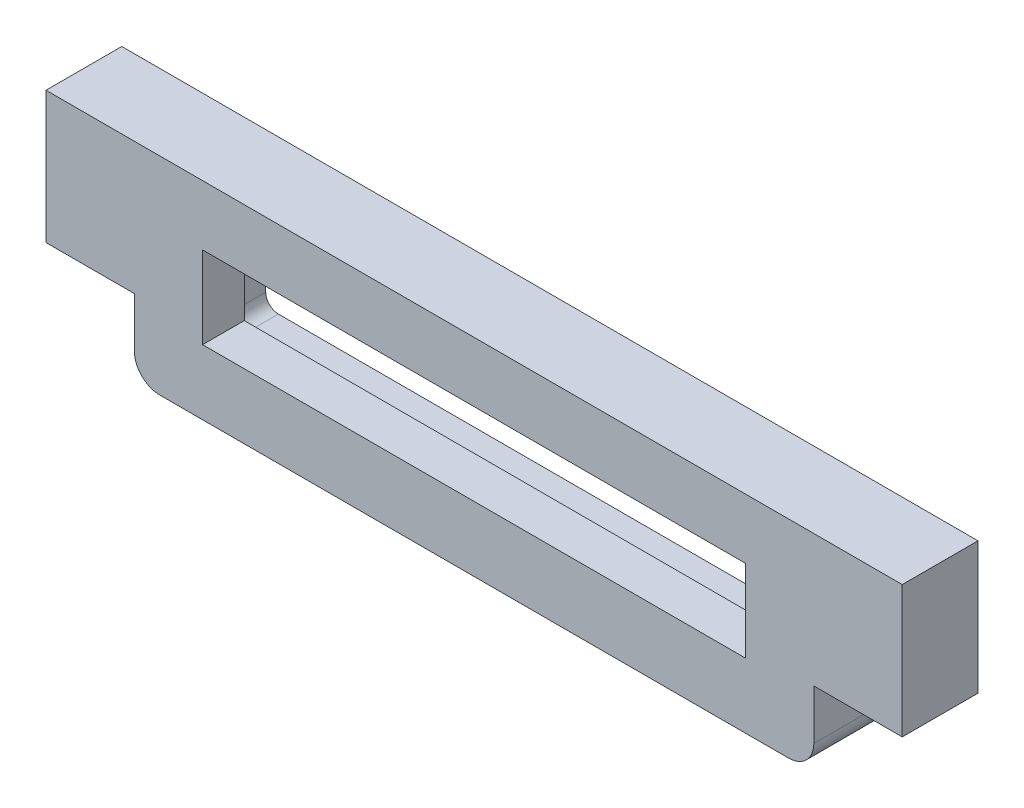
SolidWorks part; units mm, degrees
ref_plane "Front Plane" through (0, 0, 0) normal (0, 0, 1) x (1, 0, 0)
ref_plane "Top Plane" through (0, 0, 0) normal (0, 1, 0) x (1, 0, 0)
ref_plane "Right Plane" through (0, 0, 0) normal (1, 0, 0) x (0, 0, -1)
sketch "Sketch1" plane through (0, 0, 0) normal (0, 0, 1) x (1, 0, 0)
  line L0 (0, 20.5563) -> (0, -8) construction
  line L1 (-28.8085, 0) -> (32.7718, 0) construction
  line L3 (26.9, 8.4) -> (-26.9, 8.4)
  line L4 (26.9, 8.4) -> (26.9, -8.4)
  line L5 (26.9, -8.4) -> (-26.9, -8.4)
  line L6 (-26.9, 8.4) -> (-26.9, -8.4)
  line L7 (26.9, 8.4) -> (-26.9, -8.4) construction
  line L8 (26.9, -8.4) -> (-26.9, 8.4) construction
  line L12 (-21, 2.75) -> (-21, -2.75)
  line L17 (-21, -2.75) -> (21, -2.75)
  line L18 (21, -2.75) -> (21, 2.75)
  line L19 (21, 2.75) -> (-21, 2.75)
  point P5 (0, 0)
  point P10 (0, 0)
  point P13 (0, 2.75)
  point P16 (21, 0)
  dimension "D1" = 16.8
  dimension "D2" = 42
  dimension "D3" = 5.9
  dimension "D4" = 5.5
  dimension "D5" = 53.8
extrude "Boss-Extrude1" add sketch "Sketch1" along normal mid plane 54
sketch "Sketch4" plane through (0, 0, 0) normal (0, 0, 1) x (1, 0, 0)
  line L0 (21, -2.75) -> (21, 2.75) construction
  line L1 (-21, -2.75) -> (21, -2.75) construction
  line L2 (-21, 2.75) -> (-21, -2.75) construction
  line L3 (21, 2.75) -> (-21, 2.75) construction
  line L4 (21, -2.75) -> (21, 2.75) construction
  line L5 (-21, -2.75) -> (21, -2.75) construction
  line L6 (-21, 2.75) -> (-21, -2.75) construction
  line L7 (21, 2.75) -> (-21, 2.75) construction
  line L8 (22.2, -3.95) -> (22.2, 3.95)
  line L9 (22.2, 3.95) -> (-22.2, 3.95)
  line L10 (-22.2, 3.95) -> (-22.2, -3.95)
  line L11 (-22.2, -3.95) -> (22.2, -3.95)
  line L12 (-26.9, -8.4) -> (26.9, -8.4) construction
  line L13 (26.9, -8.4) -> (26.9, 8.4) construction
  line L14 (26.9, 8.4) -> (-26.9, 8.4) construction
  line L15 (-26.9, 8.4) -> (-26.9, -8.4) construction
  line L16 (-26.9, -8.4) -> (26.9, -8.4)
  line L17 (26.9, -8.4) -> (26.9, 8.4)
  line L18 (26.9, 8.4) -> (-26.9, 8.4)
  line L19 (-26.9, 8.4) -> (-26.9, -8.4)
  dimension "D1" = 1.2
extrude "Cut-Extrude2" cut sketch "Sketch4" against normal mid plane 38.7
sketch "Sketch2" plane through (0, 0, 19.35) normal (0, 0, -1) x (-1, 0, 0)
  line L0 (0, 12.8087) -> (0, -16.4683) construction
  line L1 (21, -2.75) -> (-21, -2.75) construction
  line L3 (-26.9, -2.45) -> (-26.9, 7.55)
  line L6 (-26.9, -2.45) -> (-33.9, -2.45)
  line L7 (-26.9, -2.45) -> (-26.9, 7.55)
  line L8 (-26.9, 7.55) -> (-33.9, 7.55)
  line L9 (-33.9, -2.45) -> (-33.9, 7.55)
  line L13 (-26.9, -8.4) -> (-26.9, 8.4) construction
  line L16 (33.9, -2.45) -> (33.9, 7.55)
  line L17 (26.9, 7.55) -> (33.9, 7.55)
  line L18 (26.9, -2.45) -> (26.9, 7.55)
  line L19 (26.9, -2.45) -> (33.9, -2.45)
  line L20 (26.9, -2.45) -> (26.9, 7.55)
  dimension "D1" = 7
  dimension "D2" = 10
  dimension "D3" = 0.3
extrude "Boss-Extrude2" add sketch "Sketch2" against normal blind 6 contours L9 L6 L3 L8 | L17 L18 L19 L16
sketch "Sketch3" plane through (0, -2.45, 0) normal (0, -1, 0) x (1, 0, 0)
  line L0 (0, 34.141) -> (0, 0) construction
  line L1 (-26.9, 25.35) -> (-26.9, 19.35) construction
  line L4 (-33.9, 19.35) -> (-33.9, 25.35) construction
  circle A0 centre (-30.7, 22.35) radius 1.35
  circle A2 centre (30.7, 22.35) radius 1.35
  point P10 (-33.9, 22.35)
  dimension "D1" = 2.7
  dimension "D2" = 3.8
extrude "Cut-Extrude1" cut sketch "Sketch3" against normal blind 8 contours A0 | A2
mirror "Mirror8" about plane through (0, 0, 0) normal (0, 0, 1) of "Cut-Extrude1", "Boss-Extrude2"
sketch "Sketch7" plane through (0, 0, -27) normal (0, 0, -1) x (-1, 0, 0)
  line L0 (26.9, 8.4) -> (26.9, -8.4) construction
  line L1 (-26.9, 8.4) -> (26.9, 8.4)
  line L2 (-26.9, 8.4) -> (-26.9, 7.9)
  line L3 (-26.9, 7.9) -> (26.9, 7.9)
  line L4 (26.9, 8.4) -> (26.9, 7.9)
  dimension "D1" = 0.5
extrude "Cut-Extrude4" cut sketch "Sketch7" against normal up to next
fillet "Fillet2" radius 1 4 edges at (-22.2, -3.95, 0) (22.2, -3.95, 0) (22.2, 3.95, 0) (-22.2, 3.95, 0)
fillet "Filete1" radius 2 8 edges at (-26.9, -8.4, -23.175) (26.9, -8.4, -23.175) (26.9, -8.4, 23.175) (-26.9, -8.4, 23.175) (26.9, 8.4, 23.175) (-26.9, 8.4, 23.175) (-26.9, 7.9, -23.175) (26.9, 7.9, -23.175)
sketch "Sketch5" plane through (0, 0, 27) normal (0, 0, 1) x (1, 0, 0)
  line L0 (24.9, 8.4) -> (-24.9, 8.4) construction
  line L1 (-26.9, -8.4) -> (26.9, -8.4)
  line L2 (-26.9, -8.4) -> (-26.9, 8.4)
  line L3 (-26.9, 8.4) -> (26.9, 8.4)
  line L4 (26.9, -8.4) -> (26.9, 8.4)
  line L5 (-26.9, -8.4) -> (26.9, 8.4) construction
  line L6 (-26.9, 8.4) -> (26.9, -8.4) construction
  line L7 (-26.9, 6.4) -> (-26.9, -6.4) construction
  point P0 (0, 0)
extrude "Cut-Extrude3" cut sketch "Sketch5" against normal up to surface (1.65 mm away)
chamfer "Chamfer1" distance 1 angle 45 1 edges at (0, 7.9, -19.35)
sketch "Sketch8" plane through (0, 0, -25.35) normal (0, 0, -1) x (-1, 0, 0)
  line L0 (-26.0303, 7.55) -> (-33.9, 7.55)
  line L1 (-33.9, 7.55) -> (-33.9, 4.55)
  line L2 (-33.9, -2.45) -> (-33.9, 7.55) construction
  line L3 (-33.9, 4.55) -> (-26.9, 4.55)
  line L4 (-26.9, -6.4) -> (-26.9, 5.9) construction
  line L5 (-26.9, 4.55) -> (-26.9, 5.9)
  line L6 (-26.9, -2.45) -> (-33.9, -2.45) construction
  line L7 (0, 0) -> (0, 22.4575) construction
  line L8 (26.9, 4.55) -> (26.9, 5.9)
  line L9 (33.9, 4.55) -> (26.9, 4.55)
  line L10 (33.9, 7.55) -> (33.9, 4.55)
  line L11 (26.0303, 7.55) -> (33.9, 7.55)
  arc A0 (-24.9, 7.9) -> (-26.9, 5.9) centre (-24.9, 5.9) ccw construction
  arc A1 (-26.0303, 7.55) -> (-26.9, 5.9) centre (-24.9, 5.9) ccw
  arc A2 (26.0303, 7.55) -> (26.9, 5.9) centre (24.9, 5.9) cw
  dimension "D1" = 7
extrude "Cut-Extrude5" cut sketch "Sketch8" against normal up to next
sketch "Sketch11" plane through (0, 0, -27) normal (0, 0, -1) x (-1, 0, 0)
  line L4 (26.9, -6.4) -> (26.9, 5.9)
  line L5 (24.9, 7.9) -> (-24.9, 7.9)
  line L6 (-26.9, 5.9) -> (-26.9, -6.4)
  line L7 (-24.9, -8.4) -> (24.9, -8.4)
  line L8 (26.9, -6.4) -> (26.9, 5.9)
  line L9 (24.9, 7.9) -> (-24.9, 7.9)
  line L10 (-26.9, 5.9) -> (-26.9, -6.4)
  line L11 (-24.9, -8.4) -> (24.9, -8.4)
  arc A4 (26.9, 5.9) -> (24.9, 7.9) centre (24.9, 5.9) ccw
  arc A5 (-24.9, 7.9) -> (-26.9, 5.9) centre (-24.9, 5.9) ccw
  arc A6 (-26.9, -6.4) -> (-24.9, -8.4) centre (-24.9, -6.4) ccw
  arc A7 (24.9, -8.4) -> (26.9, -6.4) centre (24.9, -6.4) ccw
  arc A8 (26.9, 5.9) -> (24.9, 7.9) centre (24.9, 5.9) ccw
  arc A9 (-24.9, 7.9) -> (-26.9, 5.9) centre (-24.9, 5.9) ccw
  arc A10 (-26.9, -6.4) -> (-24.9, -8.4) centre (-24.9, -6.4) ccw
  arc A11 (24.9, -8.4) -> (26.9, -6.4) centre (24.9, -6.4) ccw
  dimension "D1" = 0
extrude "Cut-Extrude7" cut sketch "Sketch11" against normal blind 1.2
sketch "Sketch12" plane through (-33.9, 0, 0) normal (-1, 0, 0) x (0, 0, 1)
  line L5 (19.35, -8.4) -> (-25.8, -8.4)
  line L6 (19.35, -8.4) -> (19.35, 7.9)
  line L7 (19.35, 7.9) -> (-25.8, 7.9)
  line L8 (-25.8, -8.4) -> (-25.8, 7.9)
extrude "Cut-Extrude8" cut sketch "Sketch12" against normal through all
sketch "Sketch14" plane through (0, 0, 19.35) normal (0, 0, -1) x (-1, 0, 0)
  line L0 (21, 2.75) -> (21, -2.75) construction
  line L1 (21, -2.75) -> (-21, -2.75) construction
  line L2 (-21, -2.75) -> (-21, 2.75) construction
  line L3 (-21, 2.75) -> (21, 2.75) construction
  line L4 (21, 2.75) -> (21, -2.75)
  line L5 (21, -2.75) -> (-21, -2.75)
  line L6 (-21, -2.75) -> (-21, 2.75)
  line L7 (-21, 2.75) -> (21, 2.75)
  line L9 (22.4, -4.15) -> (-22.4, -4.15)
  line L11 (-22.4, 4.15) -> (22.4, 4.15)
  line L12 (-22.4, -4.15) -> (-22.4, 4.15) construction
  line L13 (22.4, 4.15) -> (22.4, -4.15) construction
  line L14 (-22.5, -4.15) -> (-22.5, 4.15)
  line L15 (-22.5, 4.15) -> (-22.4, 4.15)
  line L16 (-22.5, -4.15) -> (-22.4, -4.15)
  line L17 (22.4, 4.15) -> (22.5, 4.15)
  line L18 (22.5, 4.15) -> (22.5, -4.15)
  line L19 (22.5, -4.15) -> (22.4, -4.15)
  dimension "D1" = 1.4
  dimension "D2" = 0.1
extrude "Cut-Extrude9" cut sketch "Sketch14" against normal blind 2.7
fillet "Fillet6" radius 1 4 edges at (-22.5, 4.15, 20.7) (-22.5, -4.15, 20.7) (22.5, -4.15, 20.7) (22.5, 4.15, 20.7)
sketch "Sketch15" plane through (0, 0, 25.35) normal (0, 0, 1) x (1, 0, 0)
  line L0 (-26.1, 8) -> (26.1, 8)
  line L1 (24.9, 8.4) -> (-24.9, 8.4) construction
  line L2 (24.9, 8.4) -> (-24.9, 8.4)
  arc A0 (-24.9, 8.4) -> (-26.5363, 7.55) centre (-24.9, 6.4) ccw construction
  arc A1 (26.5363, 7.55) -> (24.9, 8.4) centre (24.9, 6.4) ccw construction
  arc A2 (-24.9, 8.4) -> (-26.1, 8) centre (-24.9, 6.4) ccw
  arc A3 (26.1, 8) -> (24.9, 8.4) centre (24.9, 6.4) ccw
  dimension "D1" = 0.4
extrude "Cut-Extrude10" cut sketch "Sketch15" against normal up to next
sketch "Sketch16" plane through (0, 0, 25.35) normal (0, 0, 1) x (1, 0, 0)
  line L0 (21, 2.75) -> (21, -2.75) construction
  line L1 (-21, 2.75) -> (21, 2.75) construction
  line L2 (-21, -2.75) -> (-21, 2.75) construction
  line L3 (21, -2.75) -> (-21, -2.75) construction
  line L4 (21, 2.75) -> (21, -2.75)
  line L5 (-21, 2.75) -> (21, 2.75)
  line L6 (-21, -2.75) -> (-21, 2.75)
  line L7 (21, -2.75) -> (-21, -2.75)
  line L8 (21.5, 3.25) -> (21.5, -3.25)
  line L9 (21.5, -3.25) -> (-21.5, -3.25)
  line L10 (-21.5, -3.25) -> (-21.5, 3.25)
  line L11 (-21.5, 3.25) -> (21.5, 3.25)
  dimension "D1" = 0.5
extrude "Cut-Extrude11" cut sketch "Sketch16" against normal through all
sketch "Sketch18" plane through (0, 0, 25.35) normal (0, 0, 1) x (1, 0, 0)
  line L0 (-26.1, 8) -> (-33.9, 8)
  line L1 (-33.9, 8) -> (-33.9, 7.55)
  line L2 (-26.5363, 7.55) -> (-33.9, 7.55) construction
  line L3 (-26.5363, 7.55) -> (-33.9, 7.55)
  line L4 (0, 0) -> (0, 16.046) construction
  line L5 (26.5363, 7.55) -> (33.9, 7.55)
  line L6 (33.9, 8) -> (33.9, 7.55)
  line L7 (26.1, 8) -> (33.9, 8)
  arc A0 (-26.1, 8) -> (-26.5363, 7.55) centre (-24.9, 6.4) ccw construction
  arc A1 (-26.1, 8) -> (-26.5363, 7.55) centre (-24.9, 6.4) ccw
  arc A2 (26.1, 8) -> (26.5363, 7.55) centre (24.9, 6.4) cw
extrude "Boss-Extrude3" add sketch "Sketch18" against normal up to surface (6 mm away)
